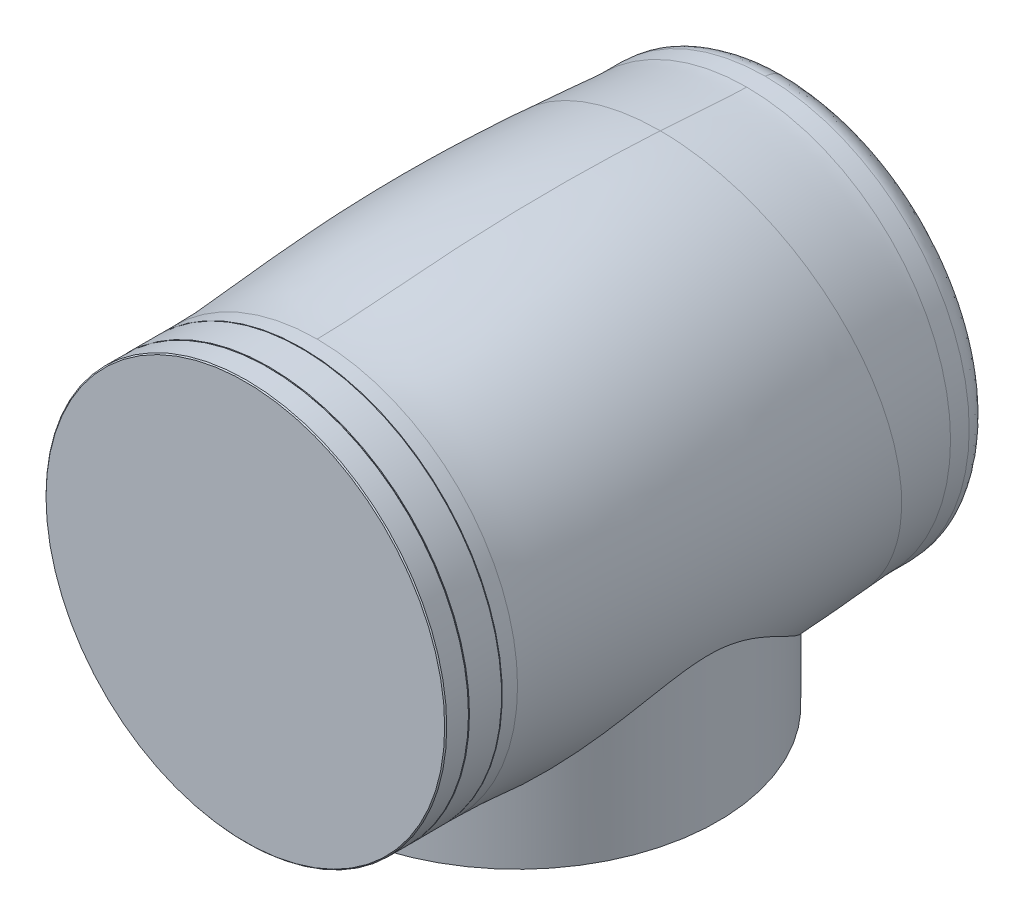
SolidWorks part; units mm, degrees
ref_plane "前视基准面" through (0, 0, 0) normal (0, 0, 1) x (1, 0, 0)
ref_plane "上视基准面" through (0, 0, 0) normal (0, 1, 0) x (1, 0, 0)
ref_plane "右视基准面" through (0, 0, 0) normal (1, 0, 0) x (0, 0, -1)
imported_body "输入1"
other "删除面1"
sketch "草图1" plane through (0, 1782.65, 0) normal (0, -1, 0) x (1, 0, 0)
  circle A0 centre (0, -366) radius 1
  dimension "D1" = 2
extrude "切除-拉伸1" cut sketch "草图1" against normal blind 3
sketch "草图2" plane through (0, 0, -243.5) normal (0, 0, 1) x (1, 0, 0)
  circle A0 centre (0, 1787.65) radius 1
  circle A1 centre (0, 1846.65) radius 59 construction
  dimension "D1" = 2
extrude "切除-拉伸2" cut sketch "草图2" against normal blind 3
